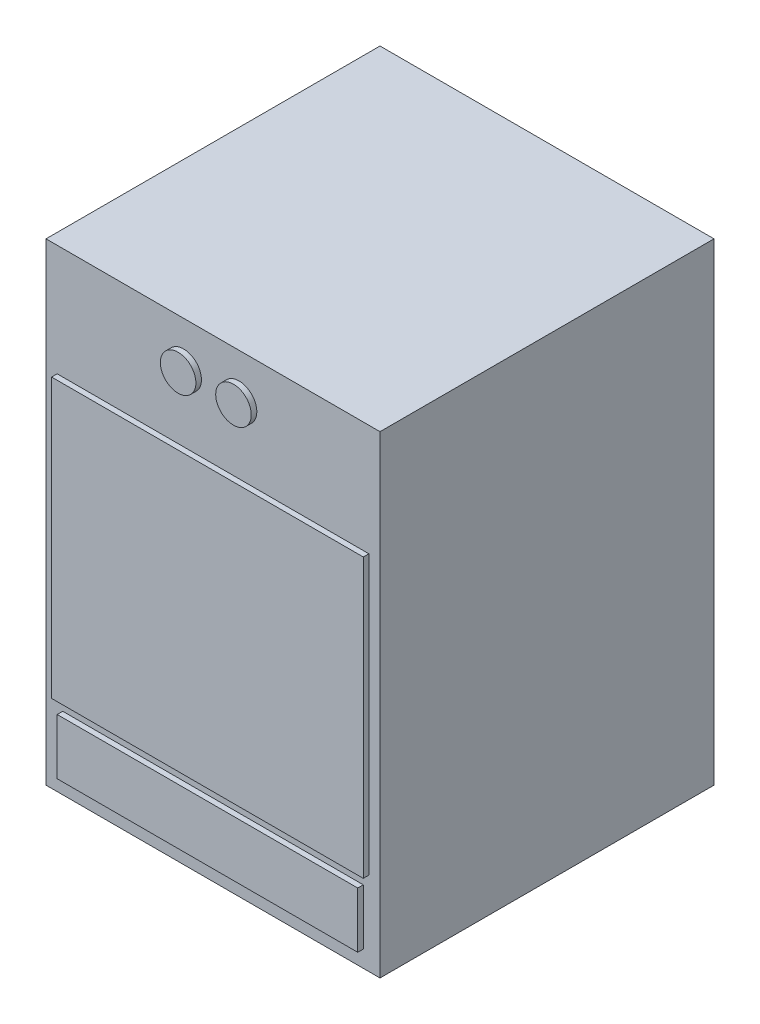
SolidWorks part; units mm, degrees
ref_plane "Plan de face" through (0, 0, 0) normal (0, 0, 1) x (1, 0, 0)
ref_plane "Plan de dessus" through (0, 0, 0) normal (0, 1, 0) x (1, 0, 0)
ref_plane "Plan de droite" through (0, 0, 0) normal (1, 0, 0) x (0, 0, -1)
sketch "Esquisse1" plane through (0, 0, 0) normal (0, 1, 0) x (1, 0, 0)
  line L1 (300, -300) -> (-300, -300)
  line L2 (300, -300) -> (300, 300)
  line L3 (300, 300) -> (-300, 300)
  line L4 (-300, -300) -> (-300, 300)
  line L5 (300, -300) -> (-300, 300) construction
  line L6 (300, 300) -> (-300, -300) construction
  point P0 (0, 0)
  dimension "D1" = 600
  dimension "D2" = 600
extrude "Boss.-Extru.1" add sketch "Esquisse1" along normal blind 850
sketch "Esquisse3" plane through (0, 0, 300) normal (0, 0, 1) x (1, 0, 0)
  circle A0 centre (-52.7012, 770.3565) radius 31.9295
  circle A1 centre (46.7714, 770.3565) radius 31.9295
extrude "Boss.-Extru.2" add sketch "Esquisse3" along normal blind 10
sketch "Esquisse4" plane through (0, 0, 300) normal (0, 0, 1) x (1, 0, 0)
  line L0 (-300, 0) -> (300, 0) construction
  line L1 (-270, 30) -> (270, 30)
  line L2 (-270, 30) -> (-270, 130)
  line L3 (-270, 130) -> (270, 130)
  line L4 (270, 30) -> (270, 130)
  line L5 (300, 850) -> (300, 0) construction
  line L6 (-300, 850) -> (-300, 0) construction
  dimension "D1" = 30
  dimension "D2" = 30
  dimension "D3" = 30
  dimension "D4" = 100
extrude "Boss.-Extru.3" add sketch "Esquisse4" along normal blind 10
sketch "Esquisse5" plane through (0, 0, 300) normal (0, 0, 1) x (1, 0, 0)
  line L0 (-300, 850) -> (-300, 0) construction
  line L1 (-280, 150) -> (280, 150)
  line L2 (-280, 150) -> (-280, 650)
  line L3 (-280, 650) -> (280, 650)
  line L4 (280, 150) -> (280, 650)
  line L5 (300, 850) -> (300, 0) construction
  line L6 (270, 130) -> (-270, 130) construction
  dimension "D1" = 20
  dimension "D2" = 20
  dimension "D3" = 500
  dimension "D4" = 20
extrude "Boss.-Extru.4" add sketch "Esquisse5" along normal blind 10
